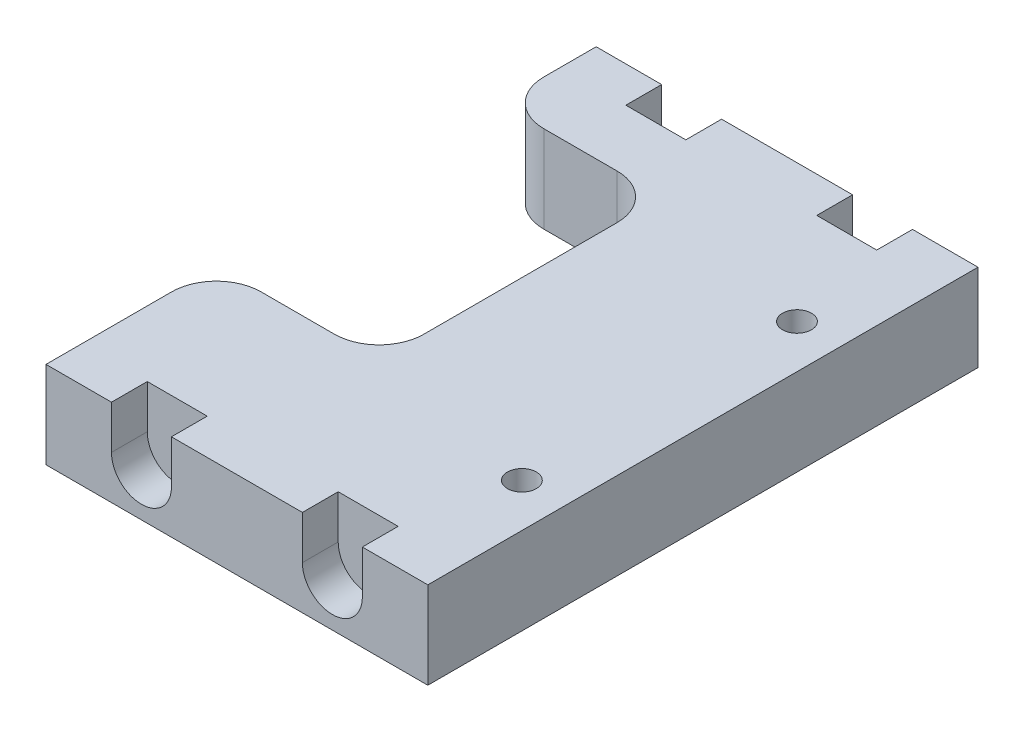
SolidWorks part; units mm, degrees
ref_plane "Front Plane" through (0, 0, 0) normal (0, 0, 1) x (1, 0, 0)
ref_plane "Top Plane" through (0, 0, 0) normal (0, 1, 0) x (1, 0, 0)
ref_plane "Right Plane" through (0, 0, 0) normal (1, 0, 0) x (0, 0, -1)
sketch "Sketch1" plane through (0, 0, 0) normal (0, 0, 1) x (1, 0, 0)
  line L6 (-810.8141, 612.9135) -> (-817.6657, 612.9135)
  line L7 (-810.8141, 612.9135) -> (-779.225, 612.9135)
  line L8 (-493.7649, 564.4955) -> (-493.7649, 1167.7963)
  line L9 (-493.7649, 1167.7963) -> (-817.6657, 1167.7963)
  line L10 (-817.6657, 1167.7963) -> (-817.6657, 564.4955)
  line L11 (-817.6657, 564.4955) -> (-493.7649, 564.4955)
  line L12 (-779.225, 612.9135) -> (-779.225, 571.3471)
  line L13 (-779.225, 571.3471) -> (-779.225, 564.4955)
  circle A2 centre (-798.6157, 583.5455) radius 2.667
extrude "Boss-Extrude1" add sketch "Sketch1" along normal blind 6.35 contours L13 L12 L7 L6 L10 L11 A2
sketch "Sketch2" plane through (0, 0, 6.35) normal (0, 0, 1) x (1, 0, 0)
  line L0 (-779.225, 564.4955) -> (-779.225, 555.0975)
  line L1 (-817.6657, 612.9135) -> (-827.0637, 612.9135)
  line L3 (-827.0637, 612.9135) -> (-779.225, 612.9135)
  line L4 (-779.225, 564.4955) -> (-779.225, 612.9135)
  line L5 (-779.225, 612.9135) -> (-817.6657, 612.9135)
  line L6 (-817.6657, 612.9135) -> (-817.6657, 564.4955)
  line L7 (-817.6657, 564.4955) -> (-779.225, 564.4955)
  line L8 (-779.225, 564.4955) -> (-779.225, 612.9135)
  line L9 (-779.225, 612.9135) -> (-817.6657, 612.9135)
  line L10 (-817.6657, 612.9135) -> (-817.6657, 564.4955)
  line L11 (-817.6657, 564.4955) -> (-779.225, 564.4955)
  line L12 (-827.0637, 612.9135) -> (-827.0637, 555.0975)
  line L13 (-827.0637, 555.0975) -> (-779.225, 555.0975)
  line L14 (-779.225, 612.9135) -> (-779.225, 555.0975)
  dimension "D2" = 9.398
  dimension "D1" = 0
extrude "Boss-Extrude2" add sketch "Sketch2" against normal up to vertex (996.0964 mm away) contours L12 L13 L0 L1 M15 M14
sketch "Sketch6" plane through (0, 0, 0) normal (0, 0, -1) x (-1, 0, 0)
  line L4 (779.225, 612.9135) -> (779.225, 555.0975)
  line L5 (779.225, 555.0975) -> (827.0637, 555.0975)
  line L6 (827.0637, 555.0975) -> (827.0637, 612.9135)
  line L7 (827.0637, 612.9135) -> (779.225, 612.9135)
  line L8 (779.225, 612.9135) -> (779.225, 555.0975)
  line L9 (779.225, 555.0975) -> (827.0637, 555.0975)
  line L10 (827.0637, 555.0975) -> (827.0637, 612.9135)
  line L11 (827.0637, 612.9135) -> (779.225, 612.9135)
  line L12 (804.9657, 562.1587) -> (817.4117, 562.1587)
  line L14 (819.1897, 562.1587) -> (820.0025, 562.1587)
  line L15 (820.0025, 562.1587) -> (820.0025, 612.9135)
  line L20 (817.4117, 562.1587) -> (819.1897, 562.1587)
  line L21 (804.9657, 562.1587) -> (779.225, 562.1587)
  dimension "D1" = 0
extrude "Boss-Extrude4" add sketch "Sketch6" along normal up to surface (78.0796 mm away) contours L12 L21 L8 L15 L14 L20 M11 M12 M13
sketch "Sketch7" plane through (0, 0, -78.0796) normal (0, 0, -1) x (-1, 0, 0)
  line L6 (805.2197, 576.9415) -> (805.2197, 612.9135)
  line L7 (779.225, 576.9415) -> (804.6609, 576.9415)
  line L8 (820.0025, 612.9135) -> (827.0637, 612.9135)
  line L9 (827.0637, 612.9135) -> (827.0637, 555.0975)
  line L10 (827.0637, 555.0975) -> (779.225, 555.0975)
  line L11 (779.225, 555.0975) -> (779.225, 562.1587)
  line L12 (779.225, 562.1587) -> (779.225, 576.9415)
  line L13 (820.0025, 612.9135) -> (805.2197, 612.9135)
  line L14 (804.6609, 576.9415) -> (805.2197, 576.9415)
  circle A2 centre (791.9609, 571.3471) radius 2.3812
  circle A3 centre (810.8141, 600.2587) radius 2.3812
sketch "Sketch8" plane through (0, 0, -78.0796) normal (0, 0, -1) x (-1, 0, 0)
  line L9 (805.2197, 612.9135) -> (805.2197, 576.9415)
  line L10 (820.0025, 612.9135) -> (805.2197, 612.9135)
  line L11 (827.0637, 612.9135) -> (820.0025, 612.9135)
  line L12 (827.0637, 555.0975) -> (827.0637, 612.9135)
  line L13 (779.225, 555.0975) -> (827.0637, 555.0975)
  line L14 (779.225, 562.1587) -> (779.225, 555.0975)
  line L15 (779.225, 576.9415) -> (779.225, 562.1587)
  line L16 (804.6609, 576.9415) -> (779.225, 576.9415)
  line L17 (805.2197, 576.9415) -> (804.6609, 576.9415)
  line L18 (805.2197, 612.9135) -> (805.2197, 576.9415)
  line L19 (820.0025, 612.9135) -> (805.2197, 612.9135)
  line L20 (827.0637, 612.9135) -> (820.0025, 612.9135)
  line L21 (827.0637, 555.0975) -> (827.0637, 612.9135)
  line L22 (779.225, 555.0975) -> (827.0637, 555.0975)
  line L23 (779.225, 562.1587) -> (779.225, 555.0975)
  line L24 (779.225, 576.9415) -> (779.225, 562.1587)
  line L25 (804.6609, 576.9415) -> (779.225, 576.9415)
  line L26 (805.2197, 576.9415) -> (804.6609, 576.9415)
  circle A1 centre (810.8141, 600.2587) radius 2.3813
  circle A2 centre (810.8141, 600.2587) radius 2.3812
  circle A3 centre (791.9609, 571.3471) radius 2.3813
  circle A4 centre (791.9609, 571.3471) radius 2.3812
  dimension "D1" = 0
  dimension "D2" = 0
  dimension "D3" = 0
extrude "Boss-Extrude6" add sketch "Sketch8" along normal blind 2.54
other "Cavity1"
other "5 SIDED ENCLOSURE 3 INCH.stp<1>@Assem11"
sketch "Sketch9" plane through (0, 612.9135, 0) normal (0, 1, 0) x (1, 0, 0)
  line L0 (-820.7645, 76.454) -> (-820.8153, 73.0504)
  line L1 (-820.8153, 3.1496) -> (-820.8153, 0)
  line L2 (-820.8153, 0) -> (-820.0025, 0)
  line L3 (-820.0025, 76.454) -> (-820.0025, 78.0796)
  line L4 (-820.0025, 78.0796) -> (-820.0025, 0)
  line L5 (-820.8153, 0) -> (-821.0693, 0)
  line L6 (-821.0693, 0) -> (-821.0693, 78.0796)
  line L7 (-821.0693, 78.0796) -> (-820.7645, 78.0796)
  line L12 (-820.7645, 76.454) -> (-820.7645, 78.0796)
  line L13 (-820.7645, 78.0796) -> (-805.2197, 78.0796)
  line L14 (-805.2197, 78.0796) -> (-805.2197, 80.6196)
  line L15 (-805.2197, 80.6196) -> (-827.0637, 80.6196)
  line L16 (-827.0637, 80.6196) -> (-827.0637, -6.35)
  line L17 (-827.0637, -6.35) -> (-779.225, -6.35)
  line L18 (-779.225, -6.35) -> (-779.225, 0)
  line L19 (-779.225, 0) -> (-820.0025, 0)
  line L20 (-820.0025, 0) -> (-820.0025, 1.0379)
  line L21 (-820.8153, 3.1496) -> (-820.8153, 73.0504)
  line L22 (-820.0025, 75.1621) -> (-820.0025, 76.454)
  line L23 (-820.0025, 76.454) -> (-820.7645, 76.454)
  line L24 (-820.7645, 76.454) -> (-820.7645, 78.0796)
  line L25 (-820.7645, 78.0796) -> (-805.2197, 78.0796)
  line L26 (-805.2197, 78.0796) -> (-805.2197, 80.6196)
  line L27 (-805.2197, 80.6196) -> (-827.0637, 80.6196)
  line L28 (-827.0637, 80.6196) -> (-827.0637, -6.35)
  line L29 (-827.0637, -6.35) -> (-779.225, -6.35)
  line L30 (-779.225, -6.35) -> (-779.225, 0)
  line L31 (-779.225, 0) -> (-820.0025, 0)
  line L32 (-820.0025, 0) -> (-820.0025, 1.0379)
  line L33 (-820.8153, 3.1496) -> (-820.8153, 73.0504)
  line L34 (-820.0025, 75.1621) -> (-820.0025, 76.454)
  line L35 (-820.0025, 76.454) -> (-820.7645, 76.454)
  arc A2 (-820.8153, 3.1496) -> (-820.0025, 1.0379) centre (-817.6657, 3.1496) ccw
  arc A3 (-820.0025, 75.1621) -> (-820.8153, 73.0504) centre (-817.6657, 73.0504) ccw
  arc A4 (-820.8153, 3.1496) -> (-820.0025, 1.0379) centre (-817.6657, 3.1496) ccw
  arc A5 (-820.0025, 75.1621) -> (-820.8153, 73.0504) centre (-817.6657, 73.0504) ccw
  dimension "D2" = 0.254
  dimension "D1" = 0
extrude "Cut-Extrude3" cut sketch "Sketch9" against normal up to surface (50.7548 mm away) contours L0 M28 M26 M27 | L7 L6 L5 L1 L0 M25 M26 M15 | L1 L2 M23 M24
sketch "Sketch10" plane through (-779.225, 0, 0) normal (1, 0, 0) x (0, 0, -1)
  line L0 (78.0796, 561.3459) -> (78.0796, 561.0919)
  line L1 (78.0796, 561.0919) -> (0, 561.0919)
  line L2 (0, 561.0919) -> (0, 562.1587)
  line L4 (24.4475, 562.1587) -> (24.4475, 561.3459) construction
  line L5 (24.4475, 562.1587) -> (24.4475, 561.3459)
  line L6 (0, 562.4127) -> (0, 562.1587)
  line L7 (0, 562.4127) -> (78.0796, 562.4127)
  line L8 (76.1963, 562.4127) -> (76.1963, 562.1587)
  line L9 (78.0796, 562.4127) -> (76.1963, 562.4127)
  line L10 (78.0796, 562.4127) -> (78.0796, 565.7277)
  line L11 (78.0796, 565.7277) -> (76.1963, 565.7277)
  line L12 (78.0796, 576.9415) -> (78.0796, 561.3459)
  line L13 (78.0796, 561.3459) -> (76.454, 561.3459)
  line L14 (76.454, 561.3459) -> (76.454, 562.1587)
  line L15 (76.454, 562.1587) -> (75.1621, 562.1587)
  line L16 (73.0504, 561.3459) -> (3.1496, 561.3459)
  line L17 (1.0379, 562.1587) -> (0, 562.1587)
  line L18 (0, 562.1587) -> (0, 612.9135)
  line L19 (0, 612.9135) -> (-6.35, 612.9135)
  line L20 (-6.35, 612.9135) -> (-6.35, 555.0975)
  line L21 (-6.35, 555.0975) -> (80.6196, 555.0975)
  line L22 (80.6196, 555.0975) -> (80.6196, 576.9415)
  line L23 (80.6196, 576.9415) -> (78.0796, 576.9415)
  line L24 (78.0796, 576.9415) -> (78.0796, 561.3459)
  line L25 (78.0796, 561.3459) -> (76.454, 561.3459)
  line L26 (76.454, 561.3459) -> (76.454, 562.1587)
  line L27 (76.454, 562.1587) -> (75.1621, 562.1587)
  line L28 (73.0504, 561.3459) -> (3.1496, 561.3459)
  line L29 (1.0379, 562.1587) -> (0, 562.1587)
  line L30 (0, 562.1587) -> (0, 612.9135)
  line L31 (0, 612.9135) -> (-6.35, 612.9135)
  line L32 (-6.35, 612.9135) -> (-6.35, 555.0975)
  line L33 (-6.35, 555.0975) -> (80.6196, 555.0975)
  line L34 (80.6196, 555.0975) -> (80.6196, 576.9415)
  line L35 (80.6196, 576.9415) -> (78.0796, 576.9415)
  line L36 (76.1963, 562.4127) -> (76.1963, 565.7277)
  line L37 (0, 561.0919) -> (3.4229, 561.0919)
  line L38 (0, 561.0919) -> (0, 564.0863)
  line L39 (0, 564.0863) -> (3.4229, 564.0863)
  line L40 (3.4229, 561.0919) -> (3.4229, 564.0863)
  arc A2 (73.0504, 561.3459) -> (75.1621, 562.1587) centre (73.0504, 564.4955) ccw
  arc A3 (1.0379, 562.1587) -> (3.1496, 561.3459) centre (3.1496, 564.4955) ccw
  arc A4 (73.0504, 561.3459) -> (75.1621, 562.1587) centre (73.0504, 564.4955) ccw
  arc A5 (1.0379, 562.1587) -> (3.1496, 561.3459) centre (3.1496, 564.4955) ccw
  dimension "D2" = 0.254
  dimension "D3" = 0.254
  dimension "D1" = 0
extrude "Cut-Extrude5" cut sketch "Sketch10" against normal up to surface (41.8444 mm away)
sketch "Sketch12" plane through (0, 0, -80.6196) normal (0, 0, -1) x (-1, 0, 0)
  line L6 (827.0637, 612.9135) -> (805.2197, 612.9135)
  line L7 (805.2197, 612.9135) -> (805.2197, 576.9415)
  line L8 (805.2197, 576.9415) -> (779.225, 576.9415)
  line L9 (779.225, 576.9415) -> (779.225, 555.0975)
  line L10 (779.225, 555.0975) -> (827.0637, 555.0975)
  line L11 (827.0637, 555.0975) -> (827.0637, 612.9135)
  line L12 (827.0637, 612.9135) -> (805.2197, 612.9135)
  line L13 (805.2197, 612.9135) -> (805.2197, 576.9415)
  line L14 (805.2197, 576.9415) -> (779.225, 576.9415)
  line L15 (779.225, 576.9415) -> (779.225, 555.0975)
  line L16 (779.225, 555.0975) -> (827.0637, 555.0975)
  line L17 (827.0637, 555.0975) -> (827.0637, 612.9135)
  circle A1 centre (791.9609, 571.3471) radius 2.3813
  circle A2 centre (791.9609, 571.3471) radius 2.3812
  circle A3 centre (810.8141, 600.2587) radius 2.3813
  circle A4 centre (810.8141, 600.2587) radius 2.3812
  dimension "D1" = 0
  dimension "D2" = 0
  dimension "D3" = 0
extrude "Boss-Extrude7" add sketch "Sketch12" along normal blind 3.81
sketch "Sketch13" plane through (0, 0, -84.4296) normal (0, 0, -1) x (-1, 0, 0)
  line L0 (797.5235, 571.3471) -> (797.5235, 576.9415)
  line L1 (805.2197, 576.9415) -> (779.225, 576.9415) construction
  line L2 (786.3983, 571.3471) -> (786.3983, 576.9415)
  line L3 (810.8141, 594.6961) -> (805.2197, 594.6961)
  line L4 (805.2197, 612.9135) -> (805.2197, 576.9415) construction
  line L5 (810.8141, 605.8213) -> (805.2197, 605.8213)
  line L12 (827.0637, 612.9135) -> (805.2197, 612.9135)
  line L13 (805.2197, 612.9135) -> (805.2197, 576.9415)
  line L14 (805.2197, 576.9415) -> (779.225, 576.9415)
  line L15 (779.225, 576.9415) -> (779.225, 555.0975)
  line L16 (779.225, 555.0975) -> (827.0637, 555.0975)
  line L17 (827.0637, 555.0975) -> (827.0637, 612.9135)
  line L18 (827.0637, 612.9135) -> (805.2197, 612.9135)
  line L19 (805.2197, 612.9135) -> (805.2197, 576.9415)
  line L20 (805.2197, 576.9415) -> (779.225, 576.9415)
  line L21 (779.225, 576.9415) -> (779.225, 555.0975)
  line L22 (779.225, 555.0975) -> (827.0637, 555.0975)
  line L23 (827.0637, 555.0975) -> (827.0637, 612.9135)
  circle A2 centre (810.8141, 600.2587) radius 3.0226
  circle A3 centre (791.9609, 571.3471) radius 3.0226
  circle A4 centre (791.9609, 571.3471) radius 5.5626
  circle A5 centre (810.8141, 600.2587) radius 5.5626
  dimension "D1" = 2.54
  dimension "D2" = 0
extrude "Cut-Extrude7" cut sketch "Sketch13" against normal blind 5.715 contours M16 | A5 A2 | A5 L5 L3 M7 | M3 | A3 M3 | A4 A3 | A4 L0 L2 M9
fillet "Fillet3" radius 1.27 4 edges at (-805.2197, 605.8213, -81.5721) (-805.2197, 594.6961, -81.5721) (-797.5235, 576.9415, -81.5721) (-786.3983, 576.9415, -81.5721)
sketch "Sketch14" plane through (0, 0, 6.35) normal (0, 0, 1) x (1, 0, 0)
  line L4 (-779.225, 612.9135) -> (-827.0637, 612.9135)
  line L5 (-827.0637, 612.9135) -> (-827.0637, 555.0975)
  line L6 (-827.0637, 555.0975) -> (-779.225, 555.0975)
  line L7 (-779.225, 555.0975) -> (-779.225, 612.9135)
  line L8 (-779.225, 612.9135) -> (-827.0637, 612.9135)
  line L9 (-827.0637, 612.9135) -> (-827.0637, 555.0975)
  line L10 (-827.0637, 555.0975) -> (-779.225, 555.0975)
  line L11 (-779.225, 555.0975) -> (-779.225, 612.9135)
  circle A1 centre (-798.6157, 583.5455) radius 12.7
  circle A2 centre (-798.6157, 583.5455) radius 12.954
  dimension "D1" = 0
  dimension "D2" = 0.254
extrude "Cut-Extrude8" cut sketch "Sketch14" against normal blind 5.715 contours A2 A1 | A1 M9 | M9
fillet "Fillet4" radius 2.54 3 edges at (-779.225, 576.9415, -81.2546) (-805.2197, 612.9135, -81.2546) (-779.225, 612.9135, 3.175)
sketch "Sketch15" plane through (0, 612.9135, 0) normal (0, 1, 0) x (1, 0, 0)
  line L4 (-827.0637, -6.35) -> (-779.225, -6.35)
  line L5 (-827.0637, 84.4296) -> (-827.0637, -6.35)
  line L6 (-779.225, 84.4296) -> (-827.0637, 84.4296)
  line L7 (-779.225, -6.35) -> (-779.225, 84.4296)
  line L8 (-827.0637, -6.35) -> (-779.225, -6.35)
  line L9 (-827.0637, 84.4296) -> (-827.0637, -6.35)
  line L10 (-779.225, 84.4296) -> (-827.0637, 84.4296)
  line L11 (-779.225, -6.35) -> (-779.225, 84.4296)
  dimension "D1" = 0
extrude "Cut-Extrude9" cut sketch "Sketch15" against normal up to surface (51.8216 mm away)
sketch "Sketch16" plane through (0, 555.0975, 0) normal (0, -1, 0) x (1, 0, 0)
  line L4 (-779.225, 6.35) -> (-827.0637, 6.35)
  line L5 (-827.0637, 6.35) -> (-827.0637, -84.4296)
  line L6 (-827.0637, -84.4296) -> (-779.225, -84.4296)
  line L7 (-779.225, -84.4296) -> (-779.225, 6.35)
  line L8 (-779.225, 6.35) -> (-827.0637, 6.35)
  line L9 (-827.0637, 6.35) -> (-827.0637, -84.4296)
  line L10 (-827.0637, -84.4296) -> (-779.225, -84.4296)
  line L11 (-779.225, -84.4296) -> (-779.225, 6.35)
  dimension "D1" = 0
extrude "Boss-Extrude8" add sketch "Sketch16" along normal blind 6.35
sketch "Sketch17" plane through (-827.0637, 0, 0) normal (-1, 0, 0) x (0, 0, 1)
  line L4 (6.35, 548.7475) -> (6.35, 561.0919)
  line L5 (6.35, 561.0919) -> (-84.4296, 561.0919)
  line L6 (-84.4296, 561.0919) -> (-84.4296, 548.7475)
  line L7 (-84.4296, 548.7475) -> (6.35, 548.7475)
  line L8 (6.35, 548.7475) -> (6.35, 561.0919)
  line L9 (6.35, 561.0919) -> (-84.4296, 561.0919)
  line L10 (-84.4296, 561.0919) -> (-84.4296, 548.7475)
  line L11 (-84.4296, 548.7475) -> (6.35, 548.7475)
  dimension "D1" = 0
extrude "Boss-Extrude9" add sketch "Sketch17" along normal up to surface (6.35 mm away)
other "Cavity2"
other "Bottom<1>@Bumper Assembly1"
other "Top<1>@Bumper Assembly1"
other "Cavity3"
other "Long Side<1>@Bumper Assembly1"
sketch "Sketch18" plane through (0, 548.7475, 0) normal (0, -1, 0) x (1, 0, 0)
  line L0 (-782.4, -48.26) -> (-830.2387, -48.26) construction
  line L5 (-806.3194, -84.4296) -> (-806.3194, -10.16) construction
  line L6 (-782.4, -60.96) -> (-830.2387, -60.96) construction
  line L7 (-833.4137, -84.4296) -> (-779.225, -84.4296) construction
  line L14 (-833.4137, -84.4296) -> (-779.225, -84.4296) construction
  line L21 (-779.225, -84.4296) -> (-833.4137, 6.35) construction
  line L22 (-779.225, 6.35) -> (-833.4137, 6.35) construction
  line L27 (-782.4, -35.56) -> (-830.2387, -35.56) construction
  line L28 (-782.4, -22.86) -> (-830.2387, -22.86) construction
  line L29 (-782.4, -10.16) -> (-830.2387, -10.16) construction
  text T0 "<b>R</b>" font "Century Gothic" height in points 36
  text T1 "I" font "Century Gothic" height in points 36
  text T2 "F" font "Century Gothic" height in points 36
  text T3 "T" font "Century Gothic" height in points 36
  text T4 "S" font "Century Gothic" height in points 36
  point P1 (-806.3194, -84.4296)
  point P15 (-806.3194, -60.96)
  point P27 (-806.3194, -39.0398)
  dimension "D2" = 16.51
  dimension "D1" = 12.7
  dimension "D4" = 5
extrude "Cut-Extrude10" cut sketch "Sketch18" against normal through all
sketch "Sketch19" plane through (0, 548.7475, 0) normal (0, -1, 0) x (1, 0, 0)
  line L3 (-805.8633, -68.7754) -> (-805.2814, -68.7754)
  line L4 (-805.2814, -68.7754) -> (-805.2814, -66.8215)
  line L5 (-805.2814, -66.8215) -> (-805.9473, -66.8215)
  line L6 (-805.8633, -68.7754) -> (-805.2814, -68.7754)
  line L7 (-805.2814, -68.7754) -> (-805.2814, -66.8215)
  line L8 (-805.2814, -66.8215) -> (-805.9473, -66.8215)
  spline S2 degree 3 poles (-791.841, 1933.0183) (-785.8141, -82.8061) (-796.1442, -66.4595) (-806.4088, -66.8324) (-806.6124, -66.852) (-806.7963, -66.8768) (-806.9615, -66.9054) (-807.1064, -66.9464) (-807.2333, -66.9903) (-807.3405, -67.0451) (-807.4325, -67.1064) (-807.5095, -67.179) (-807.5774, -67.2586) (-807.6307, -67.3501) (-807.6737, -67.4498) (-807.7004, -67.5596) (-808.3447, -71.1457) (-783.6708, -77.0657) (-2799.9016, 108.2283) knots -13.020716 -13.020716 -13.020716 -13.020716 0.105558 0.202122 0.290736 0.370617 0.442748 0.507764 0.565672 0.616562 0.663447 0.708377 0.753458 0.798569 0.845127 0.893728 0.944698 5.557546 5.557546 5.557546 5.557546 only from (-805.9473, -66.8215) to (-807.7237, -67.8023)
  spline S3 degree 3 poles (-2791.4355, -321.8292) (-779.4289, -57.0269) (-808.6486, -64.5495) (-807.6793, -68.0937) (-807.6206, -68.2264) (-807.5374, -68.3477) (-807.4337, -68.4537) (-807.3148, -68.5467) (-807.1785, -68.6211) (-807.0526, -68.6718) (-806.9363, -68.701) (-806.8319, -68.722) (-806.7109, -68.7389) (-806.5733, -68.7514) (-806.4194, -68.7632) (-806.2488, -68.7706) (-793.917, -68.9867) (-781.5432, -57.7566) (-786.6414, -2068.5426) knots -4.428971 -4.428971 -4.428971 -4.428971 0.063753 0.124452 0.185322 0.2467 0.3093 0.372394 0.436875 0.505164 0.543418 0.588552 0.639762 0.697972 0.76333 0.83502 0.913895 16.367288 16.367288 16.367288 16.367288 only from (-807.7237, -67.8023) to (-805.8633, -68.7754)
  spline S4 degree 3 poles (-805.9473, -66.8215) (-806.0287, -66.8225) (-806.1846, -66.8242) (-806.4088, -66.8324) (-806.6124, -66.852) (-806.7963, -66.8768) (-806.9615, -66.9054) (-807.1064, -66.9464) (-807.2333, -66.9903) (-807.3405, -67.0451) (-807.4325, -67.1064) (-807.5095, -67.179) (-807.5774, -67.2586) (-807.6307, -67.3501) (-807.6737, -67.4498) (-807.7004, -67.5596) (-807.7216, -67.6775) (-807.723, -67.7596) (-807.7237, -67.8023) knots 0 0 0 0 0.105558 0.202122 0.290736 0.370617 0.442748 0.507764 0.565672 0.616562 0.663447 0.708377 0.753458 0.798569 0.845127 0.893728 0.944698 1 1 1 1
  spline S5 degree 3 poles (-807.7237, -67.8023) (-807.7219, -67.8528) (-807.7183, -67.9514) (-807.6793, -68.0937) (-807.6206, -68.2264) (-807.5374, -68.3477) (-807.4337, -68.4537) (-807.3148, -68.5467) (-807.1785, -68.6211) (-807.0526, -68.6718) (-806.9363, -68.701) (-806.8319, -68.722) (-806.7109, -68.7389) (-806.5733, -68.7514) (-806.4194, -68.7632) (-806.2488, -68.7706) (-806.0618, -68.7739) (-805.9314, -68.7749) (-805.8633, -68.7754) knots 0 0 0 0 0.063753 0.124452 0.185322 0.2467 0.3093 0.372394 0.436875 0.505164 0.543418 0.588552 0.639762 0.697972 0.76333 0.83502 0.913895 1 1 1 1
  dimension "D1" = 0
extrude "Cut-Extrude11" cut sketch "Sketch19" against normal up to surface (12.3444 mm away)
ref_plane "Plane1" through (-776.685, 0, 0) normal (1, 0, 0) x (0, 0, -1)
mirror "Mirror1" about plane through (-776.685, 0, 0) normal (1, 0, 0)
sketch "Sketch20" plane through (0, 548.7475, 0) normal (0, -1, 0) x (1, 0, 0)
  line L4 (-779.225, -84.4296) -> (-779.225, 6.35)
  line L5 (-779.225, 6.35) -> (-833.4137, 6.35)
  line L6 (-833.4137, 6.35) -> (-833.4137, -84.4296)
  line L7 (-833.4137, -84.4296) -> (-779.225, -84.4296)
  line L8 (-779.225, -84.4296) -> (-779.225, 6.35)
  line L9 (-779.225, 6.35) -> (-833.4137, 6.35)
  line L10 (-833.4137, 6.35) -> (-833.4137, -84.4296)
  line L11 (-833.4137, -84.4296) -> (-779.225, -84.4296)
  dimension "D1" = 0
extrude "Cut-Extrude12" cut sketch "Sketch20" against normal through all
sketch "Sketch21" plane through (0, 554.8689, 0) normal (0, 1, 0) x (1, 0, 0)
  line L4 (-726.3062, 84.4296) -> (-726.3062, -6.35)
  line L5 (-726.3062, -6.35) -> (-719.9562, -6.35)
  line L6 (-719.9562, -6.35) -> (-719.9562, 84.4296)
  line L7 (-719.9562, 84.4296) -> (-726.3062, 84.4296)
  line L8 (-726.3062, 84.4296) -> (-726.3062, -6.35)
  line L9 (-726.3062, -6.35) -> (-719.9562, -6.35)
  line L10 (-719.9562, -6.35) -> (-719.9562, 84.4296)
  line L11 (-719.9562, 84.4296) -> (-726.3062, 84.4296)
  dimension "D1" = 0
extrude "Boss-Extrude10" add sketch "Sketch21" along normal up to surface (0.2286 mm away)
sketch "Sketch22" plane through (0, 548.7475, 0) normal (0, -1, 0) x (1, 0, 0)
  line L2 (-750.1035, -11.944) -> (-748.5999, -12.8465)
  line L3 (-744.4862, -18.4123) -> (-745.7646, -17.2427)
  line L4 (-746.3179, -48.26) -> (-748.0275, -48.26)
  line L5 (-746.3179, -57.785) -> (-746.3179, -48.26)
  line L6 (-748.0275, -57.785) -> (-746.3179, -57.785)
  line L7 (-748.0275, -48.26) -> (-748.0275, -57.785)
  line L8 (-748.0886, -60.96) -> (-749.7982, -60.96)
  line L9 (-748.0886, -65.1119) -> (-748.0886, -60.96)
  line L10 (-747.5085, -65.1119) -> (-748.0886, -65.1119)
  line L11 (-745.4097, -60.96) -> (-747.5085, -65.1119)
  line L12 (-743.5093, -60.96) -> (-745.4097, -60.96)
  line L13 (-745.7073, -65.3065) -> (-743.5093, -60.96)
  line L14 (-749.7982, -70.485) -> (-747.8062, -70.485)
  line L15 (-749.7982, -60.96) -> (-749.7982, -70.485)
  line L16 (-748.0886, -60.96) -> (-749.7982, -60.96)
  line L17 (-748.0886, -65.1119) -> (-748.0886, -60.96)
  line L18 (-747.5085, -65.1119) -> (-748.0886, -65.1119)
  line L19 (-745.4097, -60.96) -> (-747.5085, -65.1119)
  line L20 (-743.5093, -60.96) -> (-745.4097, -60.96)
  line L21 (-745.7073, -65.3065) -> (-743.5093, -60.96)
  line L22 (-749.7982, -70.485) -> (-747.8062, -70.485)
  line L23 (-749.7982, -60.96) -> (-749.7982, -70.485)
  line L24 (-746.3179, -48.26) -> (-748.0275, -48.26)
  line L25 (-746.3179, -57.785) -> (-746.3179, -48.26)
  line L26 (-748.0275, -57.785) -> (-746.3179, -57.785)
  line L27 (-748.0275, -48.26) -> (-748.0275, -57.785)
  line L28 (-750.1035, -11.944) -> (-748.5999, -12.8465)
  line L29 (-744.4862, -18.4123) -> (-745.7646, -17.2427)
  line L32 (-747.9665, -30.6754) -> (-749.6761, -30.6754)
  line L33 (-747.9665, -22.86) -> (-747.9665, -30.6754)
  line L34 (-747.417, -35.56) -> (-749.1266, -35.56)
  line L35 (-747.417, -39.834) -> (-747.417, -35.56)
  line L36 (-744.4862, -39.834) -> (-747.417, -39.834)
  line L37 (-744.4862, -41.5437) -> (-744.4862, -39.834)
  line L38 (-747.417, -41.5437) -> (-744.4862, -41.5437)
  line L39 (-747.417, -43.3754) -> (-747.417, -41.5437)
  line L40 (-744.4862, -43.3754) -> (-747.417, -43.3754)
  line L41 (-744.4862, -45.085) -> (-744.4862, -43.3754)
  line L42 (-749.1266, -45.085) -> (-744.4862, -45.085)
  line L43 (-749.1266, -35.56) -> (-749.1266, -45.085)
  line L44 (-747.417, -35.56) -> (-749.1266, -35.56)
  line L45 (-747.417, -39.834) -> (-747.417, -35.56)
  line L46 (-744.4862, -39.834) -> (-747.417, -39.834)
  line L47 (-744.4862, -41.5437) -> (-744.4862, -39.834)
  line L48 (-747.417, -41.5437) -> (-744.4862, -41.5437)
  line L49 (-747.417, -43.3754) -> (-747.417, -41.5437)
  line L50 (-744.4862, -43.3754) -> (-747.417, -43.3754)
  line L51 (-744.4862, -45.085) -> (-744.4862, -43.3754)
  line L52 (-749.1266, -45.085) -> (-744.4862, -45.085)
  line L53 (-749.1266, -35.56) -> (-749.1266, -45.085)
  line L54 (-746.2569, -22.86) -> (-747.9665, -22.86)
  line L55 (-746.2569, -30.6754) -> (-746.2569, -22.86)
  line L56 (-744.5472, -30.6754) -> (-746.2569, -30.6754)
  line L57 (-744.5472, -32.385) -> (-744.5472, -30.6754)
  line L58 (-749.6761, -32.385) -> (-744.5472, -32.385)
  line L59 (-749.6761, -30.6754) -> (-749.6761, -32.385)
  line L60 (-747.9665, -30.6754) -> (-749.6761, -30.6754)
  line L61 (-747.9665, -22.86) -> (-747.9665, -30.6754)
  line L62 (-746.2569, -22.86) -> (-747.9665, -22.86)
  line L63 (-746.2569, -30.6754) -> (-746.2569, -22.86)
  line L64 (-744.5472, -30.6754) -> (-746.2569, -30.6754)
  line L65 (-744.5472, -32.385) -> (-744.5472, -30.6754)
  line L66 (-749.6761, -32.385) -> (-744.5472, -32.385)
  line L67 (-749.6761, -30.6754) -> (-749.6761, -32.385)
  spline S2 degree 3 poles (3253.275, 74.1316) (-777.0296, -87.0287) (-743.1812, -76.4884) (-743.9603, -67.3408) (-743.9945, -67.1334) (-744.0447, -66.9361) (-744.1048, -66.747) (-744.1826, -66.5691) (-744.2711, -66.3991) (-744.376, -66.2399) (-744.4912, -66.088) (-744.6251, -65.949) (-744.77, -65.8163) (-744.9303, -65.6944) (-745.1056, -65.584) (-745.2925, -65.4807) (-753.0233, -61.8543) (-775.2465, -93.9017) (743.44, 3646.85) knots -8.197893 -8.197893 -8.197893 -8.197893 0.068738 0.134783 0.198527 0.260938 0.320957 0.379897 0.438493 0.496142 0.55425 0.612731 0.672493 0.733974 0.796799 0.861942 0.929401 8.604127 8.604127 8.604127 8.604127 only from (-743.9367, -67.7794) to (-745.7073, -65.3065)
  spline S3 degree 3 poles (-712.7597, -4070.0176) (-779.4214, -36.678) (-762.9373, -71.0909) (-747.0561, -70.4694) (-746.7206, -70.45) (-746.414, -70.4186) (-746.1367, -70.3826) (-745.8891, -70.3342) (-745.6705, -70.2805) (-745.478, -70.2144) (-745.3048, -70.1385) (-745.1439, -70.0525) (-744.9914, -69.9541) (-744.8484, -69.8437) (-744.7105, -69.7255) (-744.585, -69.5925) (-744.4664, -69.4491) (-744.356, -69.2953) (-744.2568, -69.1315) (-744.1712, -68.9596) (-744.0976, -68.7807) (-744.0393, -68.5941) (-743.9928, -68.4003) (-743.9617, -68.1999) (-743.1235, -60.6665) (-782.8085, -50.9653) (3250.9611, -266.0624) knots -8.591711 -8.591711 -8.591711 -8.591711 0.072858 0.140126 0.202191 0.258785 0.31065 0.356897 0.398298 0.435139 0.469338 0.502878 0.535973 0.569621 0.602796 0.636402 0.67065 0.705713 0.741084 0.776499 0.811858 0.848034 0.884571 0.922007 0.960215 5.074251 5.074251 5.074251 5.074251 only from (-747.8062, -70.485) to (-743.9367, -67.7794)
  spline S4 degree 3 poles (-743.9367, -67.7794) (-743.9384, -67.7043) (-743.9419, -67.5571) (-743.9603, -67.3408) (-743.9945, -67.1334) (-744.0447, -66.9361) (-744.1048, -66.747) (-744.1826, -66.5691) (-744.2711, -66.3991) (-744.376, -66.2399) (-744.4912, -66.088) (-744.6251, -65.949) (-744.77, -65.8163) (-744.9303, -65.6944) (-745.1056, -65.584) (-745.2925, -65.4807) (-745.4937, -65.3863) (-745.6351, -65.3335) (-745.7073, -65.3065) knots 0 0 0 0 0.068738 0.134783 0.198527 0.260938 0.320957 0.379897 0.438493 0.496142 0.55425 0.612731 0.672493 0.733974 0.796799 0.861942 0.929401 1 1 1 1
  spline S5 degree 3 poles (-747.8062, -70.485) (-747.6745, -70.4845) (-747.4213, -70.4837) (-747.0561, -70.4694) (-746.7206, -70.45) (-746.414, -70.4186) (-746.1367, -70.3826) (-745.8891, -70.3342) (-745.6705, -70.2805) (-745.478, -70.2144) (-745.3048, -70.1385) (-745.1439, -70.0525) (-744.9914, -69.9541) (-744.8484, -69.8437) (-744.7105, -69.7255) (-744.585, -69.5925) (-744.4664, -69.4491) (-744.356, -69.2953) (-744.2568, -69.1315) (-744.1712, -68.9596) (-744.0976, -68.7807) (-744.0393, -68.5941) (-743.9928, -68.4003) (-743.9617, -68.1999) (-743.9386, -67.9923) (-743.9373, -67.8513) (-743.9367, -67.7794) knots 0 0 0 0 0.072858 0.140126 0.202191 0.258785 0.31065 0.356897 0.398298 0.435139 0.469338 0.502878 0.535973 0.569621 0.602796 0.636402 0.67065 0.705713 0.741084 0.776499 0.811858 0.848034 0.884571 0.922007 0.960215 1 1 1 1
  spline S18 degree 3 poles (-4738.905, -305.9343) (-706.306, 0.6997) (-750.7404, -10.3835) (-749.5726, -17.9921) (-749.5182, -18.2199) (-749.4399, -18.4393) (-749.335, -18.6478) (-749.211, -18.8487) (-749.0645, -19.0415) (-748.8966, -19.2218) (-748.7123, -19.3875) (-748.5157, -19.533) (-748.3087, -19.6559) (-748.0906, -19.7561) (-747.8617, -19.8343) (-747.622, -19.8895) (-739.1771, -21.0028) (-727.9792, 21.5395) (-981.6023, -4012.8319) knots -5.768343 -5.768343 -5.768343 -5.768343 0.063175 0.124462 0.184848 0.244577 0.304549 0.365432 0.427356 0.491896 0.556136 0.619244 0.681136 0.742463 0.804983 0.868247 0.932885 7.394715 7.394715 7.394715 7.394715 only from (-749.615, -17.5136) to (-747.1155, -19.9292)
  spline S19 degree 3 poles (-3309.5986, 3056.6722) (-695.6814, -10.6656) (-732.023, -0.7272) (-747.8975, -14.7609) (-748.1936, -15.0329) (-748.4551, -15.2881) (-748.6825, -15.5251) (-748.8786, -15.7418) (-749.0401, -15.9424) (-749.2075, -16.1819) (-749.3711, -16.4697) (-749.5101, -16.8176) (-751.6123, -24.9465) (-693.2528, -40.8236) (-4718.7128, 475.1467) knots -14.65106 -14.65106 -14.65106 -14.65106 0.11214 0.215231 0.309946 0.396015 0.473203 0.541905 0.602297 0.654875 0.748186 0.835255 0.918914 6.639965 6.639965 6.639965 6.639965 only from (-747.2147, -14.1707) to (-749.615, -17.5136)
  spline S20 degree 3 poles (3213.4385, -579.0677) (-790.4419, 3.5799) (-744.6437, -8.0689) (-746.0079, -12.8569) (-746.0817, -13.0203) (-746.1663, -13.1558) (-746.2546, -13.2687) (-746.3411, -13.3651) (-746.4436, -13.4738) (-746.5648, -13.5919) (-746.7022, -13.7216) (-746.8564, -13.8626) (-757.7725, -23.429) (-784.1581, -14.7776) (1817.798, -3083.0362) knots -6.709352 -6.709352 -6.709352 -6.709352 0.076338 0.155074 0.238325 0.327891 0.378865 0.43968 0.509886 0.588921 0.677472 0.775572 0.882649 21.081322 21.081322 21.081322 21.081322 only from (-745.9516, -12.5279) to (-747.2147, -14.1707)
  spline S21 degree 3 poles (-239.3817, 3955.8621) (-765.2815, -61.8263) (-752.4602, -10.1462) (-746.6155, -11.6884) (-746.4261, -11.7717) (-746.2633, -11.8928) (-746.125, -12.0309) (-746.0259, -12.1867) (-744.3487, -16.5306) (-797.2647, -31.1444) (3186.4157, 718.1825) knots -11.112171 -11.112171 -11.112171 -11.112171 0.141922 0.275349 0.405274 0.536299 0.66224 0.777967 0.88833 9.47252 9.47252 9.47252 9.47252 only from (-747.0392, -11.6254) to (-745.9516, -12.5279)
  spline S22 degree 3 poles (-4143.3921, 2102.1735) (-719.1934, -54.1648) (-754.1139, -20.3878) (-748.2577, -12.3165) (-748.0729, -12.1036) (-747.8795, -11.9303) (-747.6797, -11.794) (-747.4726, -11.6967) (-741.685, -10.0706) (-728.6327, -61.276) (-1280.4084, 3952.293) knots -13.915115 -13.915115 -13.915115 -13.915115 0.160458 0.307612 0.442139 0.566229 0.681222 0.789558 0.895029 9.282627 9.282627 9.282627 9.282627 only from (-748.5999, -12.8465) to (-747.0392, -11.6254)
  spline S23 degree 3 poles (-918.3362, 3986.0187) (-727.9692, -47.1014) (-738.6977, -9.0694) (-747.5827, -9.9435) (-747.8124, -9.9811) (-748.0334, -10.0355) (-748.2473, -10.1027) (-748.4517, -10.1903) (-748.6492, -10.2892) (-748.8393, -10.4039) (-749.0204, -10.5371) (-749.1977, -10.6836) (-749.3648, -10.8513) (-749.5283, -11.0342) (-749.6812, -11.2376) (-749.8316, -11.4553) (-755.5959, -21.1828) (-729.6165, -47.8871) (-4288.0136, 1853.7281) knots -6.774381 -6.774381 -6.774381 -6.774381 0.063568 0.125901 0.186289 0.24504 0.303437 0.361056 0.418329 0.475792 0.534074 0.593626 0.655051 0.718698 0.784919 0.853484 0.925163 9.602134 9.602134 9.602134 9.602134 only from (-747.1021, -9.9158) to (-750.1035, -11.944)
  spline S24 degree 3 poles (3245.8952, 262.8839) (-790.4838, -32.5287) (-743.0359, -20.51) (-744.288, -12.066) (-744.3465, -11.8017) (-744.4366, -11.5519) (-744.5473, -11.3138) (-744.6823, -11.0872) (-744.8474, -10.8774) (-745.0307, -10.6787) (-745.2366, -10.5004) (-745.4581, -10.3432) (-745.6954, -10.2105) (-745.9469, -10.1011) (-746.2157, -10.02) (-746.4975, -9.9586) (-756.0419, -8.7722) (-768.1402, -54.1255) (-547.55, 3984.8518) knots -5.589368 -5.589368 -5.589368 -5.589368 0.06519 0.127905 0.189015 0.248502 0.307556 0.366963 0.426931 0.48828 0.550044 0.611324 0.672163 0.734187 0.796953 0.862273 0.929637 7.307067 7.307067 7.307067 7.307067 only from (-744.242, -12.6271) to (-747.1021, -9.9158)
  spline S25 degree 3 poles (2264.9475, -2648.6747) (-794.2561, -1.4389) (-751.7021, -23.2532) (-744.7709, -14.2742) (-744.5964, -14.011) (-744.4612, -13.7488) (-744.3632, -13.4823) (-744.2919, -13.2077) (-742.9866, -4.4583) (-789.9889, 7.5667) (3247.4785, -265.4161) knots -13.376111 -13.376111 -13.376111 -13.376111 0.150802 0.289894 0.417473 0.534875 0.648075 0.762455 0.879852 11.388611 11.388611 11.388611 11.388611 only from (-745.2265, -14.8118) to (-744.242, -12.6271)
  spline S26 degree 3 poles (1815.4632, -3081.8353) (-858.2339, -104.7491) (-800.1155, -62.3511) (-746.005, -15.523) (-745.8139, -15.3554) (-745.6494, -15.2062) (-745.5067, -15.0813) (-745.392, -14.9732) (-740.4633, -10.303) (-749.0882, 8.1302) (2067.3529, -2857.7244) knots -129.787107 -129.787107 -129.787107 -129.787107 0.192953 0.366186 0.520459 0.655785 0.770623 0.865677 0.942674 13.133776 13.133776 13.133776 13.133776 only from (-746.4534, -15.9109) to (-745.2265, -14.8118)
  spline S27 degree 3 poles (-3825.0552, 2537.3882) (-735.0048, -42.1498) (-751.4053, -21.1194) (-747.58, -16.9455) (-747.4569, -16.8249) (-747.3101, -16.6804) (-747.1339, -16.5176) (-746.9324, -16.3317) (-724.4033, 3.3832) (-712.4436, 34.4968) (2020.1812, -2903.5452) knots -9.267262 -9.267262 -9.267262 -9.267262 0.059231 0.13713 0.233823 0.348656 0.483195 0.636695 0.809253 50.765023 50.765023 50.765023 50.765023 only from (-747.747, -17.1397) to (-746.4534, -15.9109)
  spline S28 degree 3 poles (-4709.5024, 533.4999) (-706.9184, -31.0254) (-748.9292, -21.1547) (-747.8676, -17.3592) (-746.1299, -13.3317) (-707.7748, -29.9652) (-4226.9894, 1956.2202) knots -23.194495 -23.194495 -23.194495 -23.194495 0.241881 0.487115 0.737838 26.946146 26.946146 26.946146 26.946146 only from (-747.9054, -17.5957) to (-747.747, -17.1397)
  spline S29 degree 3 poles (-1192.0902, -3993.2501) (-732.4343, 26.8215) (-742.6525, -19.3756) (-747.4424, -18.177) (-747.5761, -18.1168) (-747.6911, -18.0338) (-747.7836, -17.9345) (-747.8556, -17.8289) (-749.1172, -14.3539) (-704.6301, -3.1897) (-4693.5344, -673.7153) knots -12.969028 -12.969028 -12.969028 -12.969028 0.14802 0.285787 0.415605 0.546256 0.67037 0.784556 0.893342 10.616813 10.616813 10.616813 10.616813 only from (-747.1346, -18.2196) to (-747.9054, -17.5957)
  spline S30 degree 3 poles (2441.0194, -2434.364) (-768.6332, 22.9946) (-740.0341, -10.6161) (-746.095, -17.6667) (-746.2645, -17.837) (-746.4365, -17.9745) (-746.608, -18.0851) (-746.7826, -18.1615) (-751.7912, -19.5605) (-763.6876, 27.4456) (-193.3323, -3979.4665) knots -15.488966 -15.488966 -15.488966 -15.488966 0.162432 0.311848 0.448466 0.574275 0.689054 0.797558 0.900286 9.552408 9.552408 9.552408 9.552408 only from (-745.7646, -17.2427) to (-747.1346, -18.2196)
  spline S31 degree 3 poles (-384.0341, -4003.2014) (-769.3777, 30.9914) (-755.3186, -21.5644) (-746.4491, -19.8531) (-746.126, -19.7517) (-745.8648, -19.6323) (-745.6588, -19.513) (-745.5005, -19.4053) (-745.3382, -19.2817) (-745.1748, -19.1385) (-745.0042, -18.984) (-744.835, -18.8076) (-737.3371, -10.753) (-756.1613, 20.4675) (2273.0718, -2643.5339) knots -8.258385 -8.258385 -8.258385 -8.258385 0.106908 0.212971 0.319769 0.429097 0.485871 0.546571 0.611442 0.680224 0.75359 0.830757 0.913135 11.240903 11.240903 11.240903 11.240903 only from (-747.1155, -19.9292) to (-744.4862, -18.4123)
  spline S32 degree 3 poles (-749.615, -17.5136) (-749.613, -17.5952) (-749.6089, -17.7558) (-749.5726, -17.9921) (-749.5182, -18.2199) (-749.4399, -18.4393) (-749.335, -18.6478) (-749.211, -18.8487) (-749.0645, -19.0415) (-748.8966, -19.2218) (-748.7123, -19.3875) (-748.5157, -19.533) (-748.3087, -19.6559) (-748.0906, -19.7561) (-747.8617, -19.8343) (-747.622, -19.8895) (-747.3721, -19.9225) (-747.2021, -19.927) (-747.1155, -19.9292) knots 0 0 0 0 0.063175 0.124462 0.184848 0.244577 0.304549 0.365432 0.427356 0.491896 0.556136 0.619244 0.681136 0.742463 0.804983 0.868247 0.932885 1 1 1 1
  spline S33 degree 3 poles (-747.2147, -14.1707) (-747.3359, -14.2733) (-747.5686, -14.4702) (-747.8975, -14.7609) (-748.1936, -15.0329) (-748.4551, -15.2881) (-748.6825, -15.5251) (-748.8786, -15.7418) (-749.0401, -15.9424) (-749.2075, -16.1819) (-749.3711, -16.4697) (-749.5101, -16.8176) (-749.6, -17.165) (-749.6101, -17.3986) (-749.615, -17.5136) knots 0 0 0 0 0.11214 0.215231 0.309946 0.396015 0.473203 0.541905 0.602297 0.654875 0.748186 0.835255 0.918914 1 1 1 1
  spline S34 degree 3 poles (-745.9516, -12.5279) (-745.9547, -12.5822) (-745.9611, -12.6926) (-746.0079, -12.8569) (-746.0817, -13.0203) (-746.1663, -13.1558) (-746.2546, -13.2687) (-746.3411, -13.3651) (-746.4436, -13.4738) (-746.5648, -13.5919) (-746.7022, -13.7216) (-746.8564, -13.8626) (-747.029, -14.0139) (-747.1509, -14.1169) (-747.2147, -14.1707) knots 0 0 0 0 0.076338 0.155074 0.238325 0.327891 0.378865 0.43968 0.509886 0.588921 0.677472 0.775572 0.882649 1 1 1 1
  spline S35 degree 3 poles (-747.0392, -11.6254) (-746.965, -11.6284) (-746.8212, -11.6341) (-746.6155, -11.6884) (-746.4261, -11.7717) (-746.2633, -11.8928) (-746.125, -12.0309) (-746.0259, -12.1867) (-745.9616, -12.3532) (-745.9549, -12.4694) (-745.9516, -12.5279) knots 0 0 0 0 0.141922 0.275349 0.405274 0.536299 0.66224 0.777967 0.88833 1 1 1 1
  spline S36 degree 3 poles (-748.5999, -12.8465) (-748.5444, -12.75) (-748.438, -12.5651) (-748.2577, -12.3165) (-748.0729, -12.1036) (-747.8795, -11.9303) (-747.6797, -11.794) (-747.4726, -11.6967) (-747.2581, -11.6364) (-747.112, -11.6291) (-747.0392, -11.6254) knots 0 0 0 0 0.160458 0.307612 0.442139 0.566229 0.681222 0.789558 0.895029 1 1 1 1
  spline S37 degree 3 poles (-747.1021, -9.9158) (-747.1836, -9.9172) (-747.3449, -9.9201) (-747.5827, -9.9435) (-747.8124, -9.9811) (-748.0334, -10.0355) (-748.2473, -10.1027) (-748.4517, -10.1903) (-748.6492, -10.2892) (-748.8393, -10.4039) (-749.0204, -10.5371) (-749.1977, -10.6836) (-749.3648, -10.8513) (-749.5283, -11.0342) (-749.6812, -11.2376) (-749.8316, -11.4553) (-749.9722, -11.6926) (-750.0591, -11.859) (-750.1035, -11.944) knots 0 0 0 0 0.063568 0.125901 0.186289 0.24504 0.303437 0.361056 0.418329 0.475792 0.534074 0.593626 0.655051 0.718698 0.784919 0.853484 0.925163 1 1 1 1
  spline S38 degree 3 poles (-744.242, -12.6271) (-744.2437, -12.5309) (-744.247, -12.3422) (-744.288, -12.066) (-744.3465, -11.8017) (-744.4366, -11.5519) (-744.5473, -11.3138) (-744.6823, -11.0872) (-744.8474, -10.8774) (-745.0307, -10.6787) (-745.2366, -10.5004) (-745.4581, -10.3432) (-745.6954, -10.2105) (-745.9469, -10.1011) (-746.2157, -10.02) (-746.4975, -9.9586) (-746.7952, -9.9216) (-746.9984, -9.9177) (-747.1021, -9.9158) knots 0 0 0 0 0.06519 0.127905 0.189015 0.248502 0.307556 0.366963 0.426931 0.48828 0.550044 0.611324 0.672163 0.734187 0.796953 0.862273 0.929637 1 1 1 1
  spline S39 degree 3 poles (-745.2265, -14.8118) (-745.1424, -14.7209) (-744.9807, -14.546) (-744.7709, -14.2742) (-744.5964, -14.011) (-744.4612, -13.7488) (-744.3632, -13.4823) (-744.2919, -13.2077) (-744.2491, -12.921) (-744.2444, -12.7258) (-744.242, -12.6271) knots 0 0 0 0 0.150802 0.289894 0.417473 0.534875 0.648075 0.762455 0.879852 1 1 1 1
  spline S40 degree 3 poles (-746.4534, -15.9109) (-746.3732, -15.8415) (-746.2212, -15.71) (-746.005, -15.523) (-745.8139, -15.3554) (-745.6494, -15.2062) (-745.5067, -15.0813) (-745.392, -14.9732) (-745.3006, -14.8866) (-745.2487, -14.8342) (-745.2265, -14.8118) knots 0 0 0 0 0.192953 0.366186 0.520459 0.655785 0.770623 0.865677 0.942674 1 1 1 1
  spline S41 degree 3 poles (-747.747, -17.1397) (-747.7251, -17.1121) (-747.6741, -17.0483) (-747.58, -16.9455) (-747.4569, -16.8249) (-747.3101, -16.6804) (-747.1339, -16.5176) (-746.9324, -16.3317) (-746.7008, -16.129) (-746.5386, -15.986) (-746.4534, -15.9109) knots 0 0 0 0 0.059231 0.13713 0.233823 0.348656 0.483195 0.636695 0.809253 1 1 1 1
  spline S42 degree 3 poles (-747.9054, -17.5957) (-747.9037, -17.556) (-747.9003, -17.4762) (-747.8676, -17.3592) (-747.8183, -17.2448) (-747.7711, -17.1752) (-747.747, -17.1397) knots 0 0 0 0 0.241881 0.487115 0.737838 1 1 1 1
  spline S43 degree 3 poles (-747.1346, -18.2196) (-747.1889, -18.2178) (-747.2937, -18.2142) (-747.4424, -18.177) (-747.5761, -18.1168) (-747.6911, -18.0338) (-747.7836, -17.9345) (-747.8556, -17.8289) (-747.8974, -17.7138) (-747.9028, -17.6348) (-747.9054, -17.5957) knots 0 0 0 0 0.14802 0.285787 0.415605 0.546256 0.67037 0.784556 0.893342 1 1 1 1
  spline S44 degree 3 poles (-745.7646, -17.2427) (-745.8193, -17.32) (-745.9244, -17.4683) (-746.095, -17.6667) (-746.2645, -17.837) (-746.4365, -17.9745) (-746.608, -18.0851) (-746.7826, -18.1615) (-746.9583, -18.2105) (-747.0764, -18.2166) (-747.1346, -18.2196) knots 0 0 0 0 0.162432 0.311848 0.448466 0.574275 0.689054 0.797558 0.900286 1 1 1 1
  spline S45 degree 3 poles (-747.1155, -19.9292) (-747.0033, -19.9251) (-746.7797, -19.9169) (-746.4491, -19.8531) (-746.126, -19.7517) (-745.8648, -19.6323) (-745.6588, -19.513) (-745.5005, -19.4053) (-745.3382, -19.2817) (-745.1748, -19.1385) (-745.0042, -18.984) (-744.835, -18.8076) (-744.6588, -18.6183) (-744.5447, -18.4822) (-744.4862, -18.4123) knots 0 0 0 0 0.106908 0.212971 0.319769 0.429097 0.485871 0.546571 0.611442 0.680224 0.75359 0.830757 0.913135 1 1 1 1
  dimension "D1" = 0
  dimension "D2" = 0
  dimension "D3" = 0
  dimension "D4" = 0
  dimension "D5" = 0
extrude "Boss-Extrude11" add sketch "Sketch22" against normal up to surface (12.3444 mm away)
sketch "Sketch24" plane through (0, 548.7475, 0) normal (0, -1, 0) x (1, 0, 0)
  line L0 (-1045.5111, -70.485) -> (-719.9562, -70.485) construction
  line L1 (-719.9562, -84.4296) -> (-719.9562, 6.35) construction
  line L18 (-734.1802, -60.96) -> (-735.8898, -60.96)
  line L19 (-734.1802, -70.485) -> (-734.1802, -60.96)
  line L20 (-736.1722, -70.485) -> (-734.1802, -70.485)
  line L21 (-740.4692, -60.96) -> (-738.2711, -65.3065)
  line L22 (-738.5688, -60.96) -> (-740.4692, -60.96)
  line L23 (-736.4699, -65.1119) -> (-738.5688, -60.96)
  line L24 (-735.8898, -65.1119) -> (-736.4699, -65.1119)
  line L25 (-735.8898, -60.96) -> (-735.8898, -65.1119)
  line L26 (-735.9509, -48.26) -> (-737.6605, -48.26)
  line L27 (-735.9509, -57.785) -> (-735.9509, -48.26)
  line L28 (-737.6605, -57.785) -> (-735.9509, -57.785)
  line L29 (-737.6605, -48.26) -> (-737.6605, -57.785)
  line L46 (-734.8519, -35.56) -> (-736.5615, -35.56)
  line L47 (-734.8519, -45.085) -> (-734.8519, -35.56)
  line L48 (-739.4922, -45.085) -> (-734.8519, -45.085)
  line L49 (-739.4922, -43.3754) -> (-739.4922, -45.085)
  line L50 (-736.5615, -43.3754) -> (-739.4922, -43.3754)
  line L51 (-736.5615, -41.5437) -> (-736.5615, -43.3754)
  line L52 (-739.4922, -41.5437) -> (-736.5615, -41.5437)
  line L53 (-739.4922, -39.834) -> (-739.4922, -41.5437)
  line L54 (-736.5615, -39.834) -> (-739.4922, -39.834)
  line L55 (-736.5615, -35.56) -> (-736.5615, -39.834)
  line L58 (-738.2139, -17.2427) -> (-739.4922, -18.4123)
  line L59 (-735.3785, -12.8465) -> (-733.8749, -11.944)
  line L62 (-734.3023, -30.6754) -> (-736.012, -30.6754)
  line L63 (-734.3023, -32.385) -> (-734.3023, -30.6754)
  line L64 (-739.4312, -32.385) -> (-734.3023, -32.385)
  line L65 (-739.4312, -30.6754) -> (-739.4312, -32.385)
  line L66 (-737.7216, -30.6754) -> (-739.4312, -30.6754)
  line L67 (-737.7216, -22.86) -> (-737.7216, -30.6754)
  line L68 (-736.012, -22.86) -> (-737.7216, -22.86)
  line L69 (-736.012, -30.6754) -> (-736.012, -22.86)
  spline S4 degree 3 poles (-740.0418, -67.7794) (-740.0411, -67.8513) (-740.0398, -67.9923) (-740.0167, -68.1999) (-739.9856, -68.4003) (-739.9391, -68.5941) (-739.8808, -68.7807) (-739.8072, -68.9596) (-739.7217, -69.1315) (-739.6225, -69.2953) (-739.512, -69.4491) (-739.3934, -69.5925) (-739.2679, -69.7255) (-739.13, -69.8437) (-738.987, -69.9541) (-738.8345, -70.0525) (-738.6737, -70.1385) (-738.5004, -70.2144) (-738.308, -70.2805) (-738.0893, -70.3342) (-737.8418, -70.3826) (-737.5644, -70.4186) (-737.2578, -70.45) (-736.9223, -70.4694) (-736.5572, -70.4837) (-736.3039, -70.4845) (-736.1722, -70.485) knots 0 0 0 0 0.039785 0.077993 0.115429 0.151966 0.188142 0.223501 0.258916 0.294287 0.32935 0.363598 0.397204 0.430379 0.464027 0.497122 0.530662 0.564861 0.601702 0.643103 0.68935 0.741215 0.797809 0.859874 0.927142 1 1 1 1
  spline S5 degree 3 poles (-738.2711, -65.3065) (-738.3434, -65.3335) (-738.4847, -65.3863) (-738.6859, -65.4807) (-738.8729, -65.584) (-739.0482, -65.6944) (-739.2085, -65.8163) (-739.3534, -65.949) (-739.4872, -66.088) (-739.6024, -66.2399) (-739.7074, -66.3991) (-739.7958, -66.5691) (-739.8736, -66.747) (-739.9337, -66.9361) (-739.9839, -67.1334) (-740.0181, -67.3408) (-740.0366, -67.5571) (-740.04, -67.7043) (-740.0418, -67.7794) knots 0 0 0 0 0.070599 0.138058 0.203201 0.266026 0.327507 0.387269 0.44575 0.503858 0.561507 0.620103 0.679043 0.739062 0.801473 0.865217 0.931262 1 1 1 1
  spline S32 degree 3 poles (-736.863, -19.9292) (-736.7764, -19.927) (-736.6064, -19.9225) (-736.3564, -19.8895) (-736.1167, -19.8343) (-735.8879, -19.7561) (-735.6697, -19.6559) (-735.4627, -19.533) (-735.2661, -19.3875) (-735.0818, -19.2218) (-734.9139, -19.0415) (-734.7674, -18.8487) (-734.6434, -18.6478) (-734.5385, -18.4393) (-734.4603, -18.2199) (-734.4058, -17.9921) (-734.3695, -17.7558) (-734.3655, -17.5952) (-734.3634, -17.5136) knots 0 0 0 0 0.067115 0.131753 0.195017 0.257537 0.318864 0.380756 0.443864 0.508104 0.572644 0.634568 0.695451 0.755423 0.815152 0.875538 0.936825 1 1 1 1
  spline S33 degree 3 poles (-739.4922, -18.4123) (-739.4337, -18.4822) (-739.3197, -18.6183) (-739.1435, -18.8076) (-738.9742, -18.984) (-738.8036, -19.1385) (-738.6402, -19.2817) (-738.4779, -19.4053) (-738.3197, -19.513) (-738.1136, -19.6323) (-737.8525, -19.7517) (-737.5294, -19.8531) (-737.1987, -19.9169) (-736.9752, -19.9251) (-736.863, -19.9292) knots 0 0 0 0 0.086865 0.169243 0.24641 0.319776 0.388558 0.453429 0.514129 0.570903 0.680231 0.787029 0.893092 1 1 1 1
  spline S34 degree 3 poles (-736.8439, -18.2196) (-736.902, -18.2166) (-737.0202, -18.2105) (-737.1959, -18.1615) (-737.3705, -18.0851) (-737.5419, -17.9745) (-737.7139, -17.837) (-737.8834, -17.6667) (-738.054, -17.4683) (-738.1591, -17.32) (-738.2139, -17.2427) knots 0 0 0 0 0.099714 0.202442 0.310946 0.425725 0.551534 0.688152 0.837568 1 1 1 1
  spline S35 degree 3 poles (-736.073, -17.5957) (-736.0757, -17.6348) (-736.081, -17.7138) (-736.1229, -17.8289) (-736.1948, -17.9345) (-736.2873, -18.0338) (-736.4024, -18.1168) (-736.536, -18.177) (-736.6848, -18.2142) (-736.7896, -18.2178) (-736.8439, -18.2196) knots 0 0 0 0 0.106658 0.215444 0.32963 0.453744 0.584395 0.714213 0.85198 1 1 1 1
  spline S36 degree 3 poles (-736.2314, -17.1397) (-736.2073, -17.1752) (-736.1602, -17.2448) (-736.1108, -17.3592) (-736.0781, -17.4762) (-736.0747, -17.556) (-736.073, -17.5957) knots 0 0 0 0 0.262162 0.512885 0.758119 1 1 1 1
  spline S37 degree 3 poles (-737.525, -15.9109) (-737.4399, -15.986) (-737.2776, -16.129) (-737.0461, -16.3317) (-736.8445, -16.5176) (-736.6684, -16.6804) (-736.5215, -16.8249) (-736.3984, -16.9455) (-736.3043, -17.0483) (-736.2534, -17.1121) (-736.2314, -17.1397) knots 0 0 0 0 0.190747 0.363305 0.516805 0.651344 0.766177 0.86287 0.940769 1 1 1 1
  spline S38 degree 3 poles (-738.7519, -14.8118) (-738.7298, -14.8342) (-738.6778, -14.8866) (-738.5864, -14.9732) (-738.4718, -15.0813) (-738.3291, -15.2062) (-738.1646, -15.3554) (-737.9734, -15.523) (-737.7573, -15.71) (-737.6052, -15.8415) (-737.525, -15.9109) knots 0 0 0 0 0.057326 0.134323 0.229377 0.344215 0.479541 0.633814 0.807047 1 1 1 1
  spline S39 degree 3 poles (-739.7365, -12.6271) (-739.7341, -12.7258) (-739.7294, -12.921) (-739.6866, -13.2077) (-739.6152, -13.4823) (-739.5172, -13.7488) (-739.3821, -14.011) (-739.2076, -14.2742) (-738.9978, -14.546) (-738.8361, -14.7209) (-738.7519, -14.8118) knots 0 0 0 0 0.120148 0.237545 0.351925 0.465125 0.582527 0.710106 0.849198 1 1 1 1
  spline S40 degree 3 poles (-736.8763, -9.9158) (-736.9801, -9.9177) (-737.1832, -9.9216) (-737.4809, -9.9586) (-737.7627, -10.02) (-738.0315, -10.1011) (-738.283, -10.2105) (-738.5204, -10.3432) (-738.7418, -10.5004) (-738.9478, -10.6787) (-739.1311, -10.8774) (-739.2961, -11.0872) (-739.4311, -11.3138) (-739.5419, -11.5519) (-739.632, -11.8017) (-739.6905, -12.066) (-739.7314, -12.3422) (-739.7348, -12.5309) (-739.7365, -12.6271) knots 0 0 0 0 0.070363 0.137727 0.203047 0.265813 0.327837 0.388676 0.449956 0.51172 0.573069 0.633037 0.692444 0.751498 0.810985 0.872095 0.93481 1 1 1 1
  spline S41 degree 3 poles (-733.8749, -11.944) (-733.9193, -11.859) (-734.0062, -11.6926) (-734.1468, -11.4553) (-734.2973, -11.2376) (-734.4502, -11.0342) (-734.6136, -10.8513) (-734.7808, -10.6836) (-734.958, -10.5371) (-735.1391, -10.4039) (-735.3292, -10.2892) (-735.5268, -10.1903) (-735.7311, -10.1027) (-735.945, -10.0355) (-736.1661, -9.9811) (-736.3957, -9.9435) (-736.6335, -9.9201) (-736.7948, -9.9172) (-736.8763, -9.9158) knots 0 0 0 0 0.074837 0.146516 0.215081 0.281302 0.344949 0.406374 0.465926 0.524208 0.581671 0.638944 0.696563 0.75496 0.813711 0.874099 0.936432 1 1 1 1
  spline S42 degree 3 poles (-736.9393, -11.6254) (-736.8664, -11.6291) (-736.7203, -11.6364) (-736.5058, -11.6967) (-736.2987, -11.794) (-736.099, -11.9303) (-735.9055, -12.1036) (-735.7208, -12.3165) (-735.5404, -12.5651) (-735.434, -12.75) (-735.3785, -12.8465) knots 0 0 0 0 0.104971 0.210442 0.318778 0.433771 0.557861 0.692388 0.839542 1 1 1 1
  spline S43 degree 3 poles (-738.0269, -12.5279) (-738.0235, -12.4694) (-738.0168, -12.3532) (-737.9525, -12.1867) (-737.8534, -12.0309) (-737.7151, -11.8928) (-737.5523, -11.7717) (-737.3629, -11.6884) (-737.1573, -11.6341) (-737.0134, -11.6284) (-736.9393, -11.6254) knots 0 0 0 0 0.11167 0.222033 0.33776 0.463701 0.594726 0.724651 0.858078 1 1 1 1
  spline S44 degree 3 poles (-736.7637, -14.1707) (-736.8275, -14.1169) (-736.9495, -14.0139) (-737.122, -13.8626) (-737.2762, -13.7216) (-737.4136, -13.5919) (-737.5348, -13.4738) (-737.6373, -13.3651) (-737.7238, -13.2687) (-737.8121, -13.1558) (-737.8968, -13.0203) (-737.9705, -12.8569) (-738.0173, -12.6926) (-738.0237, -12.5822) (-738.0269, -12.5279) knots 0 0 0 0 0.117351 0.224428 0.322528 0.411079 0.490114 0.56032 0.621135 0.672109 0.761675 0.844926 0.923662 1 1 1 1
  spline S45 degree 3 poles (-734.3634, -17.5136) (-734.3684, -17.3986) (-734.3785, -17.165) (-734.4683, -16.8176) (-734.6074, -16.4697) (-734.7709, -16.1819) (-734.9384, -15.9424) (-735.0998, -15.7418) (-735.2959, -15.5251) (-735.5234, -15.2881) (-735.7848, -15.0329) (-736.0809, -14.7609) (-736.4098, -14.4702) (-736.6425, -14.2733) (-736.7637, -14.1707) knots 0 0 0 0 0.081086 0.164745 0.251814 0.345125 0.397703 0.458095 0.526797 0.603985 0.690054 0.784769 0.88786 1 1 1 1
  point P4 (-744.3402, -70.485)
  dimension "D1" = 24.384
extrude "Cut-Extrude14" [suppressed] cut sketch "Sketch24" against normal up to surface (12.3444 mm away)
sketch "Sketch25" plane through (0, 548.7475, 0) normal (0, -1, 0) x (1, 0, 0)
  line L0 (-748.745, 6.35) -> (-748.745, -84.4296)
  line L1 (-719.9562, -6.35) -> (-774.145, -6.35)
  line L2 (-774.145, -71.7296) -> (-719.9562, -71.7296)
  line L4 (-774.145, 6.35) -> (-774.145, -84.4296)
  line L5 (-774.145, -84.4296) -> (-719.9562, -84.4296)
  line L6 (-719.9562, -84.4296) -> (-719.9562, 6.35)
  line L7 (-719.9562, 6.35) -> (-774.145, 6.35)
  line L8 (-774.145, 6.35) -> (-774.145, -84.4296)
  line L9 (-774.145, -84.4296) -> (-719.9562, -84.4296)
  line L10 (-719.9562, -84.4296) -> (-719.9562, 6.35)
  line L11 (-719.9562, 6.35) -> (-774.145, 6.35)
  dimension "D1" = 0
  dimension "D2" = 25.4
  dimension "D3" = 12.7
extrude "Cut-Extrude15" cut sketch "Sketch25" against normal up to surface (12.5984 mm away) contours L1 L8 L2 L0
other "Cavity5"
other "Left Bumper Assembly<1>@CORNER MOUNT ASSEMBLY/Top Left<1>@Left Bumper Assembly1"
other "Left Bumper Assembly<1>@CORNER MOUNT ASSEMBLY/Bottom Left<1>@Left Bumper Assembly1"
sketch "Sketch26" plane through (0, 548.7475, 0) normal (0, -1, 0) x (1, 0, 0)
  line L1 (-769.9039, -33.147) -> (-774.6666, -33.147)
  line L2 (-769.9039, -33.147) -> (-769.9039, -55.3212)
  line L4 (-769.7004, -55.3212) -> (-769.9853, -55.3212)
  line L5 (-769.9039, -24.177) -> (-774.6666, -24.177)
  line L6 (-769.7004, -64.2912) -> (-769.9853, -64.2912)
  line L8 (-774.145, -6.35) -> (-748.745, -6.35)
  line L9 (-774.145, -6.35) -> (-774.145, -24.177)
  line L10 (-774.145, -24.177) -> (-748.745, -24.177)
  line L11 (-748.745, -6.35) -> (-748.745, -24.177)
  line L12 (-774.145, -71.7296) -> (-748.745, -71.7296)
  line L13 (-774.145, -71.7296) -> (-774.145, -64.2912)
  line L14 (-774.145, -64.2912) -> (-748.745, -64.2912)
  line L15 (-774.145, -71.7296) -> (-774.145, -78.0796)
  line L16 (-774.145, -78.0796) -> (-719.9562, -78.0796)
  line L17 (-719.9562, -78.0796) -> (-719.9562, 0)
  line L18 (-719.9562, 0) -> (-774.145, 0)
  line L19 (-774.145, 0) -> (-774.145, -6.35)
  line L20 (-774.145, -6.35) -> (-748.745, -6.35)
  line L21 (-748.745, -6.35) -> (-748.745, -71.7296)
  line L22 (-748.745, -71.7296) -> (-774.145, -71.7296)
  line L23 (-774.145, -71.7296) -> (-774.145, -78.0796)
  line L24 (-774.145, -78.0796) -> (-719.9562, -78.0796)
  line L25 (-719.9562, -78.0796) -> (-719.9562, 0)
  line L26 (-719.9562, 0) -> (-774.145, 0)
  line L27 (-774.145, 0) -> (-774.145, -6.35)
  line L28 (-774.145, -6.35) -> (-748.745, -6.35)
  line L29 (-748.745, -6.35) -> (-748.745, -71.7296)
  line L30 (-748.745, -71.7296) -> (-774.145, -71.7296)
  line L31 (-748.745, -71.7296) -> (-748.745, -64.2912)
  line L32 (-760.0126, -52.1462) -> (-760.0126, -54.9956)
  line L33 (-751.0426, -52.1462) -> (-751.0426, -54.9956)
  line L34 (-751.0426, -54.9956) -> (-751.0426, -64.2912)
  line L35 (-751.0426, -64.2912) -> (-751.0426, -24.177)
  arc A1 (-766.8332, -41.9862) -> (-772.9747, -41.9862) centre (-769.9039, -38.1) ccw
  dimension "D1" = 8.97
  dimension "D2" = 8.97
  dimension "D3" = 0
  dimension "D4" = 8.97
extrude "Boss-Extrude12" add sketch "Sketch26" against normal up to surface (12.3444 mm away) contours L14 L13 L6 M18 M17 | L5 L10 L9 M17 M16 | L35 L33 L34 L14 L10 M17
fillet "Fillet5" radius 6.35 4 edges at (-774.145, 554.9197, -64.2912) (-751.0426, 554.9197, -64.2912) (-751.0426, 554.9197, -24.177) (-774.145, 554.9197, -24.177)
sketch "Sketch27" plane through (0, 555.0975, 0) normal (0, 1, 0) x (1, 0, 0)
  line L4 (-719.9562, 78.0796) -> (-726.3062, 78.0796)
  line L5 (-726.3062, 78.0796) -> (-726.3062, 0)
  line L6 (-726.3062, 0) -> (-719.9562, 0)
  line L7 (-719.9562, 0) -> (-719.9562, 78.0796)
  line L8 (-719.9562, 78.0796) -> (-726.3062, 78.0796)
  line L9 (-726.3062, 78.0796) -> (-726.3062, 0)
  line L10 (-726.3062, 0) -> (-719.9562, 0)
  line L11 (-719.9562, 0) -> (-719.9562, 78.0796)
  dimension "D1" = 0
extrude "Boss-Extrude13" add sketch "Sketch27" along normal up to surface (5.9944 mm away)
sketch "Sketch28" plane through (0, 0, -78.0796) normal (0, 0, -1) x (-1, 0, 0)
  line L1 (1060.1638, 561.3459) -> (735.0438, 561.3459)
  line L2 (897.6038, 561.3459) -> (897.6038, 532.8523)
  line L4 (732.5038, 563.8859) -> (732.5038, 1168.4059)
  line L5 (732.5038, 866.1459) -> (797.2461, 866.1459)
  line L12 (756.3433, 1177.3721) -> (756.3433, 1171.1999)
  line L13 (756.3433, 1171.1999) -> (764.8523, 1171.1999)
  line L14 (764.8523, 1171.1999) -> (764.8523, 1177.3721)
  line L15 (729.2489, 1177.3721) -> (729.2489, 1171.1999)
  line L16 (729.2489, 1171.1999) -> (737.7579, 1171.1999)
  line L17 (737.7579, 1171.1999) -> (737.7579, 1177.3721)
  line L18 (737.7579, 561.0919) -> (737.7579, 554.9197)
  line L19 (729.2489, 561.0919) -> (737.7579, 561.0919)
  line L20 (729.2489, 554.9197) -> (729.2489, 561.0919)
  line L21 (764.8523, 561.0919) -> (764.8523, 554.9197)
  line L22 (756.3433, 561.0919) -> (764.8523, 561.0919)
  line L23 (756.3433, 554.9197) -> (756.3433, 561.0919)
  line L24 (733.5034, 554.9197) -> (760.5978, 554.9197) construction
  arc A2 (764.8523, 1177.3721) -> (756.3433, 1177.3721) centre (760.5978, 1177.3721) ccw
  arc A3 (737.7579, 1177.3721) -> (729.2489, 1177.3721) centre (733.5034, 1177.3721) ccw
  arc A4 (737.7579, 554.9197) -> (729.2489, 554.9197) centre (733.5034, 554.9197) cw
  arc A5 (764.8523, 554.9197) -> (756.3433, 554.9197) centre (760.5978, 554.9197) cw
  point P28 (747.0506, 554.9197)
extrude "Cut-Extrude16" cut sketch "Sketch28" against normal blind 5.08 contours A4 L18 L20 M3 | A5 L21 L23 M3
sketch "Sketch29" plane through (0, 0, 0) normal (0, 0, 1) x (1, 0, 0)
  line L0 (-760.5978, 554.9197) -> (-733.5034, 554.9197) construction
  line L1 (-735.7042, 1167.7963) -> (-735.7042, 564.4955)
  line L2 (-735.7042, 866.1459) -> (-719.2725, 866.1459)
  line L9 (-737.7579, 1177.3721) -> (-737.7579, 1171.1999)
  line L10 (-737.7579, 1171.1999) -> (-729.2489, 1171.1999)
  line L11 (-729.2489, 1171.1999) -> (-729.2489, 1177.3721)
  line L12 (-764.8523, 1177.3721) -> (-764.8523, 1171.1999)
  line L13 (-764.8523, 1171.1999) -> (-756.3433, 1171.1999)
  line L14 (-756.3433, 1171.1999) -> (-756.3433, 1177.3721)
  line L15 (-756.3433, 561.0919) -> (-756.3433, 554.9197)
  line L16 (-764.8523, 561.0919) -> (-756.3433, 561.0919)
  line L17 (-764.8523, 554.9197) -> (-764.8523, 561.0919)
  line L18 (-729.2489, 561.0919) -> (-729.2489, 554.9197)
  line L19 (-737.7579, 561.0919) -> (-729.2489, 561.0919)
  line L20 (-737.7579, 554.9197) -> (-737.7579, 561.0919)
  arc A2 (-729.2489, 1177.3721) -> (-737.7579, 1177.3721) centre (-733.5034, 1177.3721) ccw
  arc A3 (-756.3433, 1177.3721) -> (-764.8523, 1177.3721) centre (-760.5978, 1177.3721) ccw
  arc A4 (-756.3433, 554.9197) -> (-764.8523, 554.9197) centre (-760.5978, 554.9197) cw
  arc A5 (-729.2489, 554.9197) -> (-737.7579, 554.9197) centre (-733.5034, 554.9197) cw
  point P24 (-747.0506, 554.9197)
extrude "Cut-Extrude17" cut sketch "Sketch29" against normal blind 5.08 contours A4 L15 L17 M3 | A5 L18 L20 M3
sketch "Sketch30" plane through (0, 561.0919, 0) normal (0, 1, 0) x (1, 0, 0)
  line L6 (-726.1284, 23.7744) -> (-732.3006, 23.7744)
  line L7 (-732.3006, 23.7744) -> (-732.3006, 15.2654)
  line L8 (-732.3006, 15.2654) -> (-726.1284, 15.2654)
  line L9 (-726.1284, 62.8142) -> (-732.3006, 62.8142)
  line L10 (-732.3006, 62.8142) -> (-732.3006, 54.3052)
  line L11 (-732.3006, 54.3052) -> (-726.1284, 54.3052)
  arc A2 (-726.1284, 15.2654) -> (-726.1284, 23.7744) centre (-726.1284, 19.5199) ccw
  arc A3 (-726.1284, 54.3052) -> (-726.1284, 62.8142) centre (-726.1284, 58.5597) ccw
  circle A4 centre (-726.1284, 58.5597) radius 2.05
  circle A5 centre (-726.1284, 19.5199) radius 2.05
  dimension "D1" = 4.1
extrude "Cut-Extrude18" cut sketch "Sketch30" against normal through all contours A5 | A4
chamfer "Chamfer2" distance 1.27 angle 45 2 edges at (-726.1284, 548.7475, -17.4699) (-726.1284, 548.7475, -56.5097)
